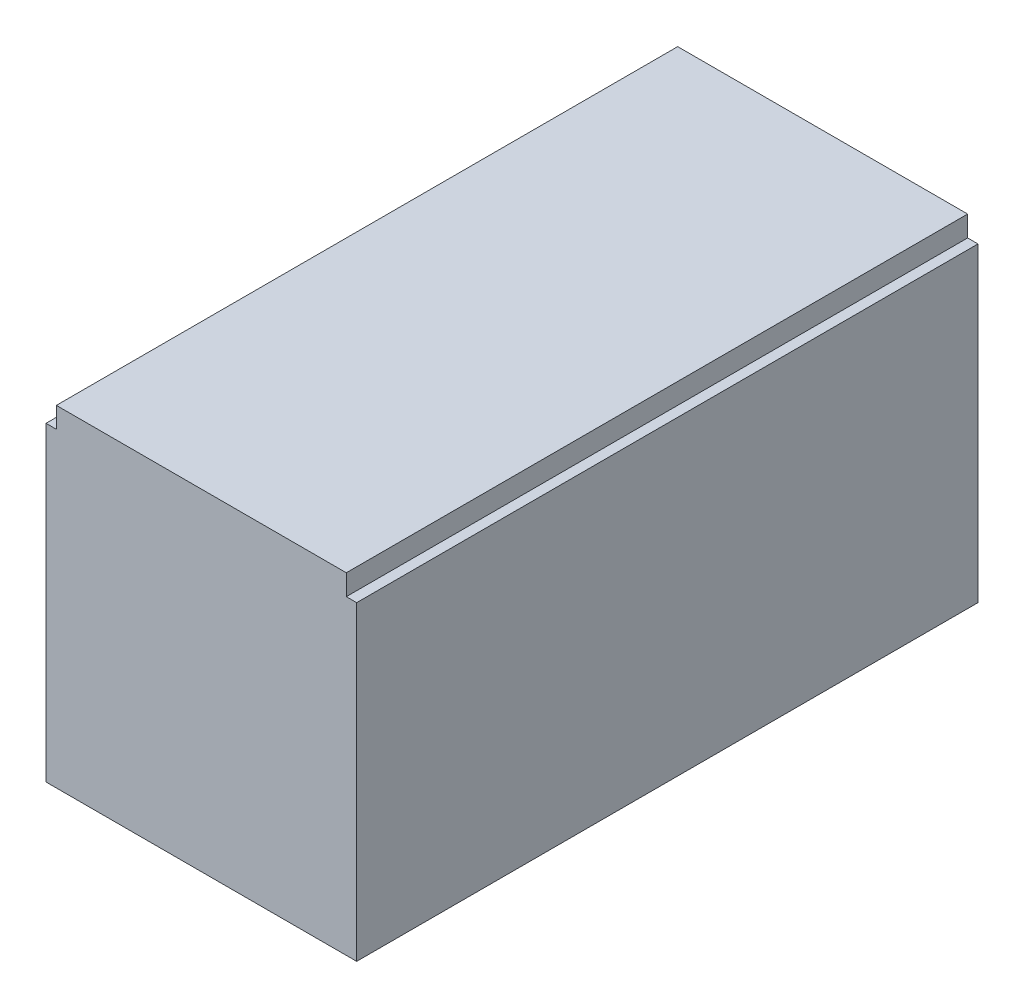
SolidWorks part; units mm, degrees
ref_plane "Front" through (0, 0, 0) normal (0, 0, 1) x (1, 0, 0)
ref_plane "Top" through (0, 0, 0) normal (0, 1, 0) x (1, 0, 0)
ref_plane "Right" through (0, 0, 0) normal (1, 0, 0) x (0, 0, -1)
sketch "Sketch1" plane through (0, 0, 0) normal (0, 1, 0) x (1, 0, 0)
  line L1 (-3.75, 15) -> (3.75, 15)
  line L2 (-3.75, 15) -> (-3.75, 0)
  line L3 (-3.75, 0) -> (3.75, 0)
  line L4 (3.75, 15) -> (3.75, 0)
  dimension "D1" = 7.5
  dimension "D2" = 15
extrude "Extrude1" add sketch "Sketch1" along normal blind 8
sketch "Sketch2" plane through (0, 8, 0) normal (0, 1, 0) x (-1, 0, 0)
  line L0 (-3.75, -15) -> (3.75, -15) construction
  line L1 (3.75, 0) -> (3.5, 0)
  line L2 (3.75, 0) -> (3.75, -15)
  line L3 (3.75, -15) -> (3.5, -15)
  line L4 (3.5, 0) -> (3.5, -15)
  line L5 (0, -15) -> (0, -13.4913) construction
  line L6 (-3.5, 0) -> (-3.5, -15)
  line L7 (-3.75, -15) -> (-3.5, -15)
  line L8 (-3.75, 0) -> (-3.75, -15)
  line L9 (-3.75, 0) -> (-3.5, 0)
  dimension "D1" = 0.25
extrude "Extrude2" cut sketch "Sketch2" against normal blind 0.5
